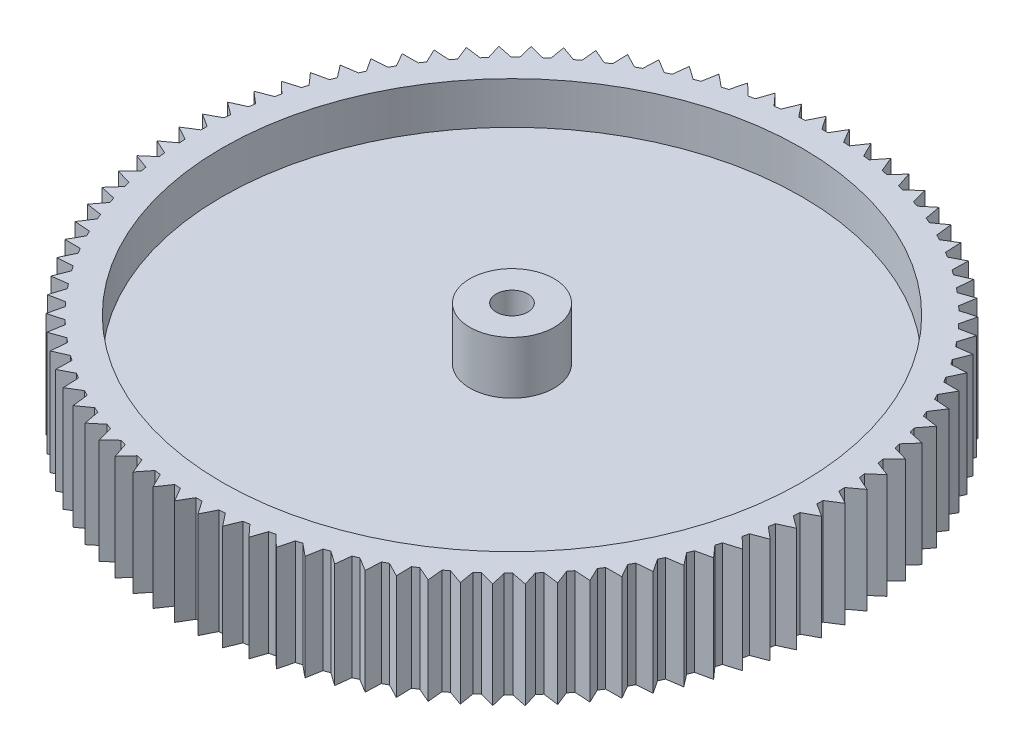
SolidWorks part; units mm, degrees
ref_plane "Plan de face" through (0, 0, 0) normal (0, 0, 1) x (1, 0, 0)
ref_plane "Plan de dessus" through (0, 0, 0) normal (0, 1, 0) x (1, 0, 0)
ref_plane "Plan de droite" through (0, 0, 0) normal (1, 0, 0) x (0, 0, -1)
ref_plane "Plan1" through (0, 10, 0) normal (0, 1, 0) x (1, 0, 0)
sketch "Esquisse1" plane through (0, 10, 0) normal (0, 1, 0) x (1, 0, 0)
  line L0 (1.5196, 29.9615) -> (0.7466, 31.2704)
  line L1 (0.7466, 31.2704) -> (0, 30)
  line L2 (-0.5741, 29.9945) -> (-1.4365, 31.2463)
  line L3 (-1.4365, 31.2463) -> (-2.0927, 29.9269)
  line L4 (-2.665, 29.8814) -> (-3.6127, 31.0699)
  line L5 (-3.6127, 31.0699) -> (-4.1752, 29.708)
  line L6 (-4.7429, 29.6227) -> (-5.7712, 30.7423)
  line L7 (-5.7712, 30.7423) -> (-6.2374, 29.3444)
  line L8 (-6.7978, 29.2197) -> (-7.9016, 30.2648)
  line L9 (-7.9016, 30.2648) -> (-8.2691, 28.8379)
  line L10 (-8.8195, 28.6743) -> (-9.9935, 29.6399)
  line L11 (-9.9935, 29.6399) -> (-10.2606, 28.1908)
  line L12 (-10.7982, 27.9893) -> (-12.0368, 28.8706)
  line L13 (-12.0368, 28.8706) -> (-12.2021, 27.4064)
  line L14 (-12.7243, 27.1678) -> (-14.0213, 27.9606)
  line L15 (-14.0213, 27.9606) -> (-14.0841, 26.4884)
  line L16 (-14.5885, 26.2141) -> (-15.9376, 26.9144)
  line L17 (-15.9376, 26.9144) -> (-15.8976, 25.4414)
  line L18 (-16.3815, 25.1326) -> (-17.7762, 25.7371)
  line L19 (-17.7762, 25.7371) -> (-17.6336, 24.2705)
  line L20 (-18.0948, 23.9286) -> (-19.5283, 24.4344)
  line L21 (-19.5283, 24.4344) -> (-19.2836, 22.9813)
  line L22 (-19.7199, 22.6081) -> (-21.1852, 23.0126)
  line L23 (-21.1852, 23.0126) -> (-20.8398, 21.5802)
  line L24 (-21.2489, 21.1774) -> (-22.7388, 21.4788)
  line L25 (-22.7388, 21.4788) -> (-22.2943, 20.0739)
  line L26 (-22.6744, 19.6436) -> (-24.1817, 19.8403)
  line L27 (-24.1817, 19.8403) -> (-23.6403, 18.4698)
  line L28 (-23.9894, 18.0141) -> (-25.5068, 18.1051)
  line L29 (-25.5068, 18.1051) -> (-24.8711, 16.7758)
  line L30 (-25.1876, 16.2968) -> (-26.7076, 16.2818)
  line L31 (-26.7076, 16.2818) -> (-25.9808, 15)
  line L32 (-26.2631, 14.5001) -> (-27.7783, 14.3791)
  line L33 (-27.7783, 14.3791) -> (-26.9638, 13.1511)
  line L34 (-27.2106, 12.6327) -> (-28.7137, 12.4063)
  line L35 (-28.7137, 12.4063) -> (-27.8155, 11.2382)
  line L36 (-28.0255, 10.7038) -> (-29.5092, 10.3731)
  line L37 (-29.5092, 10.3731) -> (-28.5317, 9.2705)
  line L38 (-28.7039, 8.7228) -> (-30.1609, 8.2894)
  line L39 (-30.1609, 8.2894) -> (-29.1089, 7.2577)
  line L40 (-29.2424, 6.6993) -> (-30.6656, 6.1653)
  line L41 (-30.6656, 6.1653) -> (-29.5442, 5.2094)
  line L42 (-29.6385, 4.6431) -> (-31.021, 4.0111)
  line L43 (-31.021, 4.0111) -> (-29.8357, 3.1359)
  line L44 (-29.8902, 2.5643) -> (-31.2253, 1.8375)
  line L45 (-31.2253, 1.8375) -> (-29.9817, 1.047)
  line L46 (-29.9963, 0.473) -> (-31.2774, -0.3452)
  line L47 (-31.2774, -0.3452) -> (-29.9817, -1.047)
  line L48 (-29.9562, -1.6205) -> (-31.1771, -2.5261)
  line L49 (-31.1771, -2.5261) -> (-29.8357, -3.1359)
  line L50 (-29.7702, -3.7062) -> (-30.9249, -4.6948)
  line L51 (-30.9249, -4.6948) -> (-29.5442, -5.2094)
  line L52 (-29.4391, -5.7739) -> (-30.5221, -6.8406)
  line L53 (-30.5221, -6.8406) -> (-29.1089, -7.2577)
  line L54 (-28.9647, -7.8134) -> (-29.9706, -8.953)
  line L55 (-29.9706, -8.953) -> (-28.5317, -9.2705)
  line L56 (-28.3491, -9.8148) -> (-29.2731, -11.0219)
  line L57 (-29.2731, -11.0219) -> (-27.8155, -11.2382)
  line L58 (-27.5954, -11.7684) -> (-28.4329, -13.037)
  line L59 (-28.4329, -13.037) -> (-26.9638, -13.1511)
  line L60 (-26.7072, -13.6647) -> (-27.4542, -14.9886)
  line L61 (-27.4542, -14.9886) -> (-25.9808, -15)
  line L62 (-25.689, -15.4944) -> (-26.3418, -16.8672)
  line L63 (-26.3418, -16.8672) -> (-24.8711, -16.7758)
  line L64 (-24.5455, -17.2487) -> (-25.101, -18.6636)
  line L65 (-25.101, -18.6636) -> (-23.6403, -18.4698)
  line L66 (-23.2825, -18.9189) -> (-23.738, -20.3691)
  line L67 (-23.738, -20.3691) -> (-22.2943, -20.0739)
  line L68 (-21.9061, -20.4969) -> (-22.2593, -21.9754)
  line L69 (-22.2593, -21.9754) -> (-20.8398, -21.5802)
  line L70 (-20.423, -21.975) -> (-20.6721, -23.4746)
  line L71 (-20.6721, -23.4746) -> (-19.2836, -22.9813)
  line L72 (-18.8403, -23.3461) -> (-18.9843, -24.8594)
  line L73 (-18.9843, -24.8594) -> (-17.6336, -24.2705)
  line L74 (-17.1659, -24.6035) -> (-17.2039, -26.1231)
  line L75 (-17.2039, -26.1231) -> (-15.8976, -25.4414)
  line L76 (-15.4078, -25.741) -> (-15.3398, -27.2596)
  line L77 (-15.3398, -27.2596) -> (-14.0841, -26.4884)
  line L78 (-13.5747, -26.7531) -> (-13.4009, -28.2632)
  line L79 (-13.4009, -28.2632) -> (-12.2021, -27.4064)
  line L80 (-11.6754, -27.6349) -> (-11.3967, -29.1292)
  line L81 (-11.3967, -29.1292) -> (-10.2606, -28.1908)
  line L82 (-9.7192, -28.382) -> (-9.337, -29.8532)
  line L83 (-9.337, -29.8532) -> (-8.2691, -28.8379)
  line L84 (-7.7157, -28.9908) -> (-7.2318, -30.4318)
  line L85 (-7.2318, -30.4318) -> (-6.2374, -29.3444)
  line L86 (-5.6747, -29.4584) -> (-5.0913, -30.8621)
  line L87 (-5.0913, -30.8621) -> (-4.1752, -29.708)
  line L88 (-3.6059, -29.7825) -> (-2.9261, -31.1421)
  line L89 (-2.9261, -31.1421) -> (-2.0927, -29.9269)
  line L90 (-1.5196, -29.9615) -> (-0.7466, -31.2704)
  line L91 (-0.7466, -31.2704) -> (0, -30)
  line L92 (0.5741, -29.9945) -> (1.4365, -31.2463)
  line L93 (1.4365, -31.2463) -> (2.0927, -29.9269)
  line L94 (2.665, -29.8814) -> (3.6127, -31.0699)
  line L95 (3.6127, -31.0699) -> (4.1752, -29.708)
  line L96 (4.7429, -29.6227) -> (5.7712, -30.7423)
  line L97 (5.7712, -30.7423) -> (6.2374, -29.3444)
  line L98 (6.7978, -29.2197) -> (7.9016, -30.2648)
  line L99 (7.9016, -30.2648) -> (8.2691, -28.8379)
  line L100 (8.8195, -28.6743) -> (9.9935, -29.6399)
  line L101 (9.9935, -29.6399) -> (10.2606, -28.1908)
  line L102 (10.7982, -27.9893) -> (12.0368, -28.8706)
  line L103 (12.0368, -28.8706) -> (12.2021, -27.4064)
  line L104 (12.7243, -27.1678) -> (14.0213, -27.9606)
  line L105 (14.0213, -27.9606) -> (14.0841, -26.4884)
  line L106 (14.5885, -26.2141) -> (15.9376, -26.9144)
  line L107 (15.9376, -26.9144) -> (15.8976, -25.4414)
  line L108 (16.3815, -25.1326) -> (17.7762, -25.7371)
  line L109 (17.7762, -25.7371) -> (17.6336, -24.2705)
  line L110 (18.0948, -23.9286) -> (19.5283, -24.4344)
  line L111 (19.5283, -24.4344) -> (19.2836, -22.9813)
  line L112 (19.7199, -22.6081) -> (21.1852, -23.0126)
  line L113 (21.1852, -23.0126) -> (20.8398, -21.5802)
  line L114 (21.2489, -21.1774) -> (22.7388, -21.4788)
  line L115 (22.7388, -21.4788) -> (22.2943, -20.0739)
  line L116 (22.6744, -19.6436) -> (24.1817, -19.8403)
  line L117 (24.1817, -19.8403) -> (23.6403, -18.4698)
  line L118 (23.9894, -18.0141) -> (25.5068, -18.1051)
  line L119 (25.5068, -18.1051) -> (24.8711, -16.7758)
  line L120 (25.1876, -16.2968) -> (26.7076, -16.2818)
  line L121 (26.7076, -16.2818) -> (25.9808, -15)
  line L122 (26.2631, -14.5001) -> (27.7783, -14.3791)
  line L123 (27.7783, -14.3791) -> (26.9638, -13.1511)
  line L124 (27.2106, -12.6327) -> (28.7137, -12.4063)
  line L125 (28.7137, -12.4063) -> (27.8155, -11.2382)
  line L126 (28.0255, -10.7038) -> (29.5092, -10.3731)
  line L127 (29.5092, -10.3731) -> (28.5317, -9.2705)
  line L128 (28.7039, -8.7228) -> (30.1609, -8.2894)
  line L129 (30.1609, -8.2894) -> (29.1089, -7.2577)
  line L130 (29.2424, -6.6993) -> (30.6656, -6.1653)
  line L131 (30.6656, -6.1653) -> (29.5442, -5.2094)
  line L132 (29.6385, -4.6431) -> (31.021, -4.0111)
  line L133 (31.021, -4.0111) -> (29.8357, -3.1359)
  line L134 (29.8902, -2.5643) -> (31.2253, -1.8375)
  line L135 (31.2253, -1.8375) -> (29.9817, -1.047)
  line L136 (29.9963, -0.473) -> (31.2774, 0.3452)
  line L137 (31.2774, 0.3452) -> (29.9817, 1.047)
  line L138 (29.9562, 1.6205) -> (31.1771, 2.5261)
  line L139 (31.1771, 2.5261) -> (29.8357, 3.1359)
  line L140 (29.7702, 3.7062) -> (30.9249, 4.6948)
  line L141 (30.9249, 4.6948) -> (29.5442, 5.2094)
  line L142 (29.4391, 5.7739) -> (30.5221, 6.8406)
  line L143 (30.5221, 6.8406) -> (29.1089, 7.2577)
  line L144 (28.9647, 7.8134) -> (29.9706, 8.953)
  line L145 (29.9706, 8.953) -> (28.5317, 9.2705)
  line L146 (28.3491, 9.8148) -> (29.2731, 11.0219)
  line L147 (29.2731, 11.0219) -> (27.8155, 11.2382)
  line L148 (27.5954, 11.7684) -> (28.4329, 13.037)
  line L149 (28.4329, 13.037) -> (26.9638, 13.1511)
  line L150 (26.7072, 13.6647) -> (27.4542, 14.9886)
  line L151 (27.4542, 14.9886) -> (25.9808, 15)
  line L152 (25.689, 15.4944) -> (26.3418, 16.8672)
  line L153 (26.3418, 16.8672) -> (24.8711, 16.7758)
  line L154 (24.5455, 17.2487) -> (25.101, 18.6636)
  line L155 (25.101, 18.6636) -> (23.6403, 18.4698)
  line L156 (23.2825, 18.9189) -> (23.738, 20.3691)
  line L157 (23.738, 20.3691) -> (22.2943, 20.0739)
  line L158 (21.9061, 20.4969) -> (22.2593, 21.9754)
  line L159 (22.2593, 21.9754) -> (20.8398, 21.5802)
  line L160 (20.423, 21.975) -> (20.6721, 23.4746)
  line L161 (20.6721, 23.4746) -> (19.2836, 22.9813)
  line L162 (18.8403, 23.3461) -> (18.9843, 24.8594)
  line L163 (18.9843, 24.8594) -> (17.6336, 24.2705)
  line L164 (17.1659, 24.6035) -> (17.2039, 26.1231)
  line L165 (17.2039, 26.1231) -> (15.8976, 25.4414)
  line L166 (15.4078, 25.741) -> (15.3398, 27.2596)
  line L167 (15.3398, 27.2596) -> (14.0841, 26.4884)
  line L168 (13.5747, 26.7531) -> (13.4009, 28.2632)
  line L169 (13.4009, 28.2632) -> (12.2021, 27.4064)
  line L170 (11.6754, 27.6349) -> (11.3967, 29.1292)
  line L171 (11.3967, 29.1292) -> (10.2606, 28.1908)
  line L172 (9.7192, 28.382) -> (9.337, 29.8532)
  line L173 (9.337, 29.8532) -> (8.2691, 28.8379)
  line L174 (7.7157, 28.9908) -> (7.2318, 30.4318)
  line L175 (7.2318, 30.4318) -> (6.2374, 29.3444)
  line L176 (5.6747, 29.4584) -> (5.0913, 30.8621)
  line L177 (5.0913, 30.8621) -> (4.1752, 29.708)
  line L178 (3.6059, 29.7825) -> (2.9261, 31.1421)
  line L179 (2.9261, 31.1421) -> (2.0927, 29.9269)
  arc A0 (0, 30) -> (-0.5741, 29.9945) centre (0, 0) ccw
  arc A1 (-2.0927, 29.9269) -> (-2.665, 29.8814) centre (0, 0) ccw
  arc A2 (-4.1752, 29.708) -> (-4.7429, 29.6227) centre (0, 0) ccw
  arc A3 (-6.2374, 29.3444) -> (-6.7978, 29.2197) centre (0, 0) ccw
  arc A4 (-8.2691, 28.8379) -> (-8.8195, 28.6743) centre (0, 0) ccw
  arc A5 (-10.2606, 28.1908) -> (-10.7982, 27.9893) centre (0, 0) ccw
  arc A6 (-12.2021, 27.4064) -> (-12.7243, 27.1678) centre (0, 0) ccw
  arc A7 (-14.0841, 26.4884) -> (-14.5885, 26.2141) centre (0, 0) ccw
  arc A8 (-15.8976, 25.4414) -> (-16.3815, 25.1326) centre (0, 0) ccw
  arc A9 (-17.6336, 24.2705) -> (-18.0948, 23.9286) centre (0, 0) ccw
  arc A10 (-19.2836, 22.9813) -> (-19.7199, 22.6081) centre (0, 0) ccw
  arc A11 (-20.8398, 21.5802) -> (-21.2489, 21.1774) centre (0, 0) ccw
  arc A12 (-22.2943, 20.0739) -> (-22.6744, 19.6436) centre (0, 0) ccw
  arc A13 (-23.6403, 18.4698) -> (-23.9894, 18.0141) centre (0, 0) ccw
  arc A14 (-24.8711, 16.7758) -> (-25.1876, 16.2968) centre (0, 0) ccw
  arc A15 (-25.9808, 15) -> (-26.2631, 14.5001) centre (0, 0) ccw
  arc A16 (-26.9638, 13.1511) -> (-27.2106, 12.6327) centre (0, 0) ccw
  arc A17 (-27.8155, 11.2382) -> (-28.0255, 10.7038) centre (0, 0) ccw
  arc A18 (-28.5317, 9.2705) -> (-28.7039, 8.7228) centre (0, 0) ccw
  arc A19 (-29.1089, 7.2577) -> (-29.2424, 6.6993) centre (0, 0) ccw
  arc A20 (-29.5442, 5.2094) -> (-29.6385, 4.6431) centre (0, 0) ccw
  arc A21 (-29.8357, 3.1359) -> (-29.8902, 2.5643) centre (0, 0) ccw
  arc A22 (-29.9817, 1.047) -> (-29.9963, 0.473) centre (0, 0) ccw
  arc A23 (-29.9817, -1.047) -> (-29.9562, -1.6205) centre (0, 0) ccw
  arc A24 (-29.8357, -3.1359) -> (-29.7702, -3.7062) centre (0, 0) ccw
  arc A25 (-29.5442, -5.2094) -> (-29.4391, -5.7739) centre (0, 0) ccw
  arc A26 (-29.1089, -7.2577) -> (-28.9647, -7.8134) centre (0, 0) ccw
  arc A27 (-28.5317, -9.2705) -> (-28.3491, -9.8148) centre (0, 0) ccw
  arc A28 (-27.8155, -11.2382) -> (-27.5954, -11.7684) centre (0, 0) ccw
  arc A29 (-26.9638, -13.1511) -> (-26.7072, -13.6647) centre (0, 0) ccw
  arc A30 (-25.9808, -15) -> (-25.689, -15.4944) centre (0, 0) ccw
  arc A31 (-24.8711, -16.7758) -> (-24.5455, -17.2487) centre (0, 0) ccw
  arc A32 (-23.6403, -18.4698) -> (-23.2825, -18.9189) centre (0, 0) ccw
  arc A33 (-22.2943, -20.0739) -> (-21.9061, -20.4969) centre (0, 0) ccw
  arc A34 (-20.8398, -21.5802) -> (-20.423, -21.975) centre (0, 0) ccw
  arc A35 (-19.2836, -22.9813) -> (-18.8403, -23.3461) centre (0, 0) ccw
  arc A36 (-17.6336, -24.2705) -> (-17.1659, -24.6035) centre (0, 0) ccw
  arc A37 (-15.8976, -25.4414) -> (-15.4078, -25.741) centre (0, 0) ccw
  arc A38 (-14.0841, -26.4884) -> (-13.5747, -26.7531) centre (0, 0) ccw
  arc A39 (-12.2021, -27.4064) -> (-11.6754, -27.6349) centre (0, 0) ccw
  arc A40 (-10.2606, -28.1908) -> (-9.7192, -28.382) centre (0, 0) ccw
  arc A41 (-8.2691, -28.8379) -> (-7.7157, -28.9908) centre (0, 0) ccw
  arc A42 (-6.2374, -29.3444) -> (-5.6747, -29.4584) centre (0, 0) ccw
  arc A43 (-4.1752, -29.708) -> (-3.6059, -29.7825) centre (0, 0) ccw
  arc A44 (-2.0927, -29.9269) -> (-1.5196, -29.9615) centre (0, 0) ccw
  arc A45 (0, -30) -> (0.5741, -29.9945) centre (0, 0) ccw
  arc A46 (2.0927, -29.9269) -> (2.665, -29.8814) centre (0, 0) ccw
  arc A47 (4.1752, -29.708) -> (4.7429, -29.6227) centre (0, 0) ccw
  arc A48 (6.2374, -29.3444) -> (6.7978, -29.2197) centre (0, 0) ccw
  arc A49 (8.2691, -28.8379) -> (8.8195, -28.6743) centre (0, 0) ccw
  arc A50 (10.2606, -28.1908) -> (10.7982, -27.9893) centre (0, 0) ccw
  arc A51 (12.2021, -27.4064) -> (12.7243, -27.1678) centre (0, 0) ccw
  arc A52 (14.0841, -26.4884) -> (14.5885, -26.2141) centre (0, 0) ccw
  arc A53 (15.8976, -25.4414) -> (16.3815, -25.1326) centre (0, 0) ccw
  arc A54 (17.6336, -24.2705) -> (18.0948, -23.9286) centre (0, 0) ccw
  arc A55 (19.2836, -22.9813) -> (19.7199, -22.6081) centre (0, 0) ccw
  arc A56 (20.8398, -21.5802) -> (21.2489, -21.1774) centre (0, 0) ccw
  arc A57 (22.2943, -20.0739) -> (22.6744, -19.6436) centre (0, 0) ccw
  arc A58 (23.6403, -18.4698) -> (23.9894, -18.0141) centre (0, 0) ccw
  arc A59 (24.8711, -16.7758) -> (25.1876, -16.2968) centre (0, 0) ccw
  arc A60 (25.9808, -15) -> (26.2631, -14.5001) centre (0, 0) ccw
  arc A61 (26.9638, -13.1511) -> (27.2106, -12.6327) centre (0, 0) ccw
  arc A62 (27.8155, -11.2382) -> (28.0255, -10.7038) centre (0, 0) ccw
  arc A63 (28.5317, -9.2705) -> (28.7039, -8.7228) centre (0, 0) ccw
  arc A64 (29.1089, -7.2577) -> (29.2424, -6.6993) centre (0, 0) ccw
  arc A65 (29.5442, -5.2094) -> (29.6385, -4.6431) centre (0, 0) ccw
  arc A66 (29.8357, -3.1359) -> (29.8902, -2.5643) centre (0, 0) ccw
  arc A67 (29.9817, -1.047) -> (29.9963, -0.473) centre (0, 0) ccw
  arc A68 (29.9817, 1.047) -> (29.9562, 1.6205) centre (0, 0) ccw
  arc A69 (29.8357, 3.1359) -> (29.7702, 3.7062) centre (0, 0) ccw
  arc A70 (29.5442, 5.2094) -> (29.4391, 5.7739) centre (0, 0) ccw
  arc A71 (29.1089, 7.2577) -> (28.9647, 7.8134) centre (0, 0) ccw
  arc A72 (28.5317, 9.2705) -> (28.3491, 9.8148) centre (0, 0) ccw
  arc A73 (27.8155, 11.2382) -> (27.5954, 11.7684) centre (0, 0) ccw
  arc A74 (26.9638, 13.1511) -> (26.7072, 13.6647) centre (0, 0) ccw
  arc A75 (25.9808, 15) -> (25.689, 15.4944) centre (0, 0) ccw
  arc A76 (24.8711, 16.7758) -> (24.5455, 17.2487) centre (0, 0) ccw
  arc A77 (23.6403, 18.4698) -> (23.2825, 18.9189) centre (0, 0) ccw
  arc A78 (22.2943, 20.0739) -> (21.9061, 20.4969) centre (0, 0) ccw
  arc A79 (20.8398, 21.5802) -> (20.423, 21.975) centre (0, 0) ccw
  arc A80 (19.2836, 22.9813) -> (18.8403, 23.3461) centre (0, 0) ccw
  arc A81 (17.6336, 24.2705) -> (17.1659, 24.6035) centre (0, 0) ccw
  arc A82 (15.8976, 25.4414) -> (15.4078, 25.741) centre (0, 0) ccw
  arc A83 (14.0841, 26.4884) -> (13.5747, 26.7531) centre (0, 0) ccw
  arc A84 (12.2021, 27.4064) -> (11.6754, 27.6349) centre (0, 0) ccw
  arc A85 (10.2606, 28.1908) -> (9.7192, 28.382) centre (0, 0) ccw
  arc A86 (8.2691, 28.8379) -> (7.7157, 28.9908) centre (0, 0) ccw
  arc A87 (6.2374, 29.3444) -> (5.6747, 29.4584) centre (0, 0) ccw
  arc A88 (4.1752, 29.708) -> (3.6059, 29.7825) centre (0, 0) ccw
  arc A89 (2.0927, 29.9269) -> (1.5196, 29.9615) centre (0, 0) ccw
extrude "Boss.-Extru.1" add sketch "Esquisse1" against normal blind 10
hole_wizard "Dégagement M481" positions "Esquisse3" profile "Esquisse2" hole size "M48" standard "Ansi Metric"
sketch "Esquisse3" plane through (0, 10, 0) normal (0, 1, 0) x (1, 0, 0)
  point P0 (0, 0)
sketch "Esquisse2" plane through (0, 10, 0) normal (1, 0, 0) x (0, 0, 1)
  line L0 (0, 0) -> (0, 4)
  line L1 (0, 4) -> (27.5, 4)
  line L2 (27.5, 4) -> (27.5, 0)
  line L5 (27.5, 0) -> (0, 0)
  line L10 (0, 4) -> (-27.5, 4) construction
  line L11 (0, -6.35) -> (0, 107.95) construction
  dimension "Diamètre du perçage" = 55
  dimension "Profondeur du perçage" = 4
  dimension "Angle de pointe" = 180
hole_wizard "Dégagement M482" positions "Esquisse5" profile "Esquisse4" hole size "M48" standard "Ansi Metric"
sketch "Esquisse5" plane through (0, 0, 0) normal (0, -1, 0) x (-1, 0, 0)
  point P0 (0, 0)
sketch "Esquisse4" plane through (0, 0, 0) normal (1, 0, 0) x (0, 0, -1)
  line L0 (0, 0) -> (0, 4)
  line L1 (0, 4) -> (27.5, 4)
  line L2 (27.5, 4) -> (27.5, 0)
  line L5 (27.5, 0) -> (0, 0)
  line L10 (0, 4) -> (-27.5, 4) construction
  line L11 (0, -6.35) -> (0, 107.95) construction
  dimension "Diamètre du perçage" = 55
  dimension "Profondeur du perçage" = 4
  dimension "Angle de pointe" = 180
sketch "Esquisse6" plane through (0, 0, 0) normal (0, 0, 1) x (1, 0, 0)
  line L0 (4, 4) -> (0, 4)
  line L1 (0, 4) -> (0, 1)
  line L2 (0, 1) -> (4, 1)
  line L3 (4, 1) -> (4, 4)
  line L4 (0, 4) -> (0, 1) construction
revolve "Révolution1" add sketch "Esquisse6" angle 360 about L4
sketch "Esquisse7" plane through (0, 0, 0) normal (0, 0, 1) x (1, 0, 0)
  line L0 (4, 11) -> (0, 11)
  line L1 (0, 11) -> (0, 6)
  line L2 (0, 6) -> (4, 6)
  line L3 (4, 6) -> (4, 11)
  line L4 (0, 11) -> (0, 6) construction
revolve "Révolution2" add sketch "Esquisse7" angle 360 about L4
hole_wizard "Diamètre du perçage Ø3.0 (3)1" positions "Esquisse9" profile "Esquisse8" hole size "Ø3.0" standard "Ansi Metric"
sketch "Esquisse9" plane through (0, 1, 0) normal (0, -1, 0) x (-1, 0, 0)
  point P0 (0, 0)
sketch "Esquisse8" plane through (0, 1, 0) normal (1, 0, 0) x (0, 0, -1)
  line L0 (0, 0) -> (0, 10)
  line L1 (0, 10) -> (1.5, 10)
  line L2 (1.5, 10) -> (1.5, 0)
  line L5 (1.5, 0) -> (0, 0)
  line L11 (0, -6.35) -> (0, 107.95) construction
  dimension "Diamètre du perçage jusqu'au prochain" = 3
  dimension "Profondeur du perçage jusqu'au prochain" = 10
